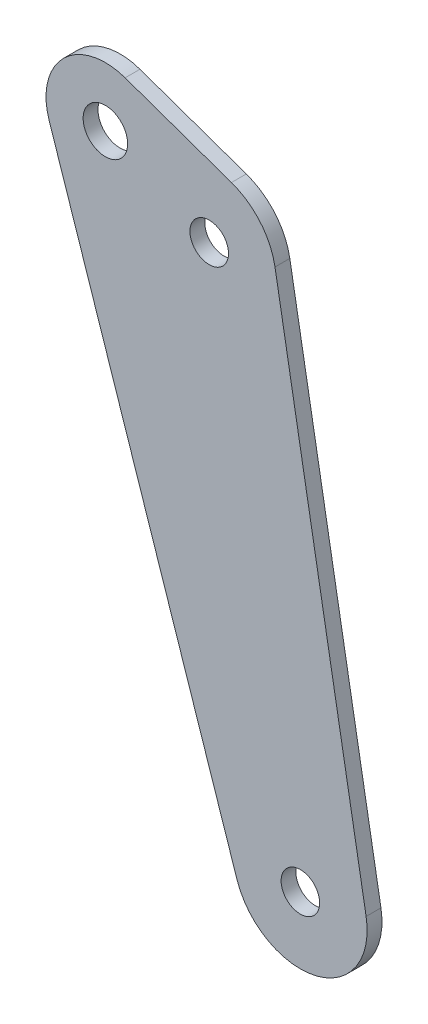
SolidWorks part; units mm, degrees
ref_plane "Alzado" through (0, 0, 0) normal (0, 0, 1) x (1, 0, 0)
ref_plane "Planta" through (0, 0, 0) normal (0, 1, 0) x (1, 0, 0)
ref_plane "Vista lateral" through (0, 0, 0) normal (1, 0, 0) x (0, 0, -1)
ref_plane "Plano1" through (0, 0, 4.2) normal (0, 0, 1) x (1, 0, 0)
sketch "Sk_Placa_jaula_exterior" plane through (0, 0, 4.2) normal (0, 0, 1) x (1, 0, 0)
  line L0 (-43.5893, -64.5304) -> (-18.2523, -140.5219)
  line L1 (-0.8511, -136.1123) -> (-13.1367, -66.4372)
  line L2 (-19.0055, -59.5128) -> (-33.3382, -54.4558)
  arc A0 (-18.2523, -140.5219) -> (-0.8511, -136.1123) centre (-9.7144, -137.6751) ccw
  arc A1 (-13.1367, -66.4372) -> (-19.0055, -59.5128) centre (-22, -68) ccw
  arc A2 (-33.3382, -54.4558) -> (-43.5893, -64.5304) centre (-36, -62) ccw
  circle A3 centre (-36, -62) radius 3
  circle A4 centre (-22, -68) radius 2.6
  circle A5 centre (-9.7144, -137.6751) radius 2.6
extrude "Placa_jaula_exterior" add sketch "Sk_Placa_jaula_exterior" along normal blind 2
